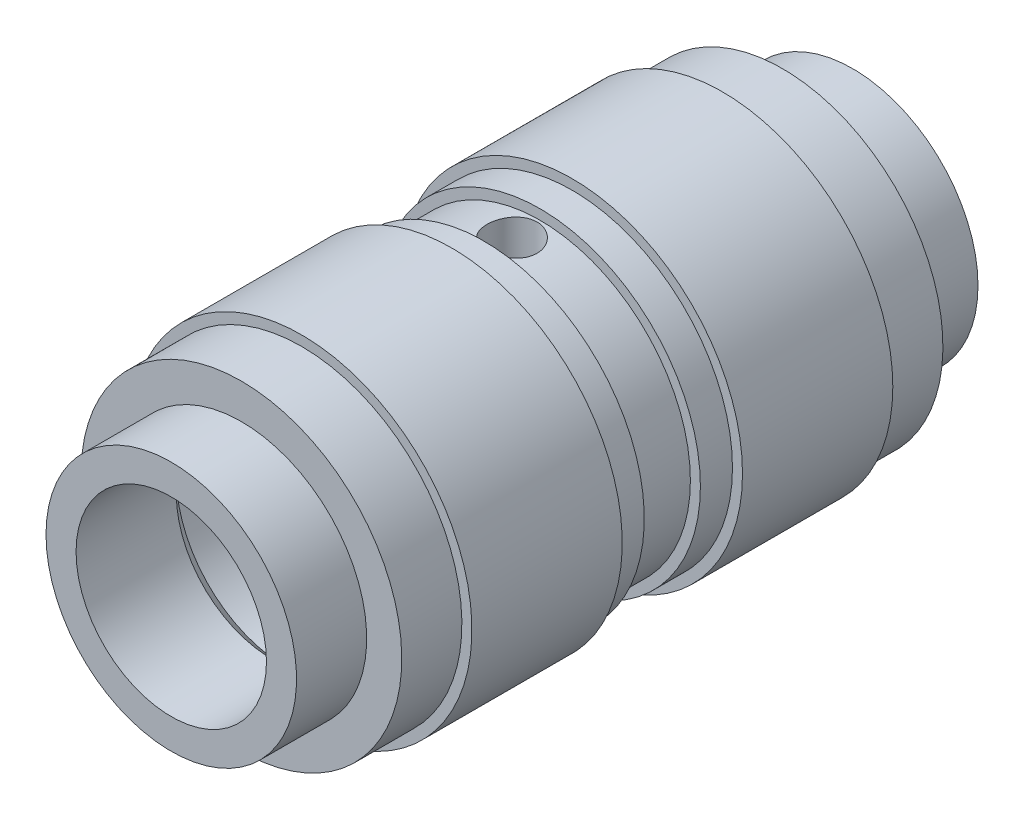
SolidWorks part; units mm, degrees
ref_plane "Face" through (0, 0, 0) normal (0, 0, 1) x (1, 0, 0)
ref_plane "Dessus" through (0, 0, 0) normal (0, 1, 0) x (1, 0, 0)
ref_plane "Droite" through (0, 0, 0) normal (1, 0, 0) x (0, 0, -1)
imported_body "Importée1"
hole_wizard "Trou taraudé M6x1.01" positions "Esquisse2" profile "Esquisse1" tap size "M6x1.0" standard "ISO"
sketch "Esquisse2" plane through (0, 0, 0) normal (0, 1, 0) x (1, 0, 0)
  point P0 (0, 0)
sketch "Esquisse1" plane through (0, 0, 0) normal (1, 0, 0) x (0, 0, -1)
  line L0 (0, 0) -> (0, 17)
  line L1 (0, 17) -> (2.5, 17)
  line L2 (2.5, 17) -> (2.5, 0)
  line L5 (2.5, 0) -> (0, 0)
  line L11 (0, -6.35) -> (0, 107.95) construction
  dimension "Diamètre du trou pour taraudage jusqu'au prochain" = 5
  dimension "Profondeur du trou pour taraudage jusqu'au prochain" = 17
